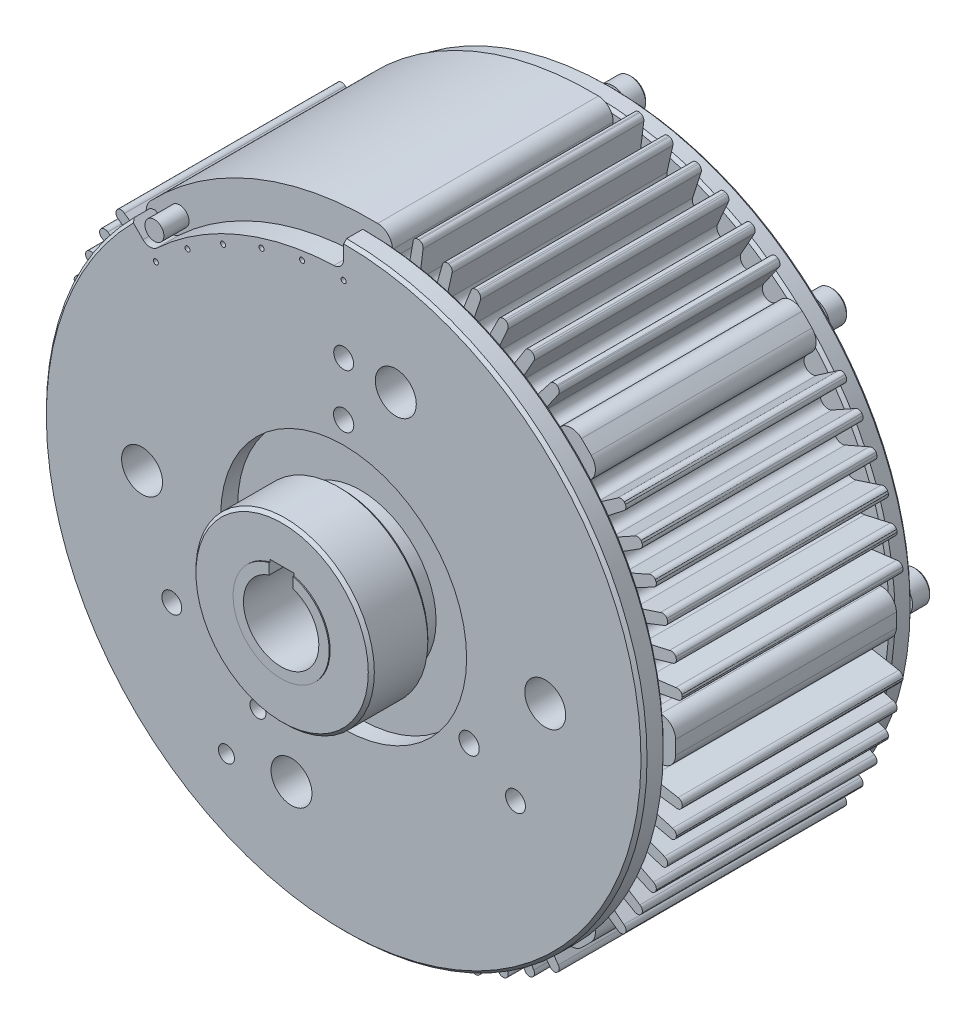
SolidWorks part; units mm, degrees
ref_plane "Front Plane" through (0, 0, 0) normal (0, 0, 1) x (1, 0, 0)
ref_plane "Top Plane" through (0, 0, 0) normal (0, 1, 0) x (1, 0, 0)
ref_plane "Right Plane" through (0, 0, 0) normal (1, 0, 0) x (0, 0, -1)
sketch "Sketch1" plane through (0, 0, 0) normal (1, 0, 0) x (0, 0, -1)
  line L0 (-15.7542, 9.5) -> (-15.7542, 12.109)
  line L1 (-15.7542, 12.109) -> (-15.506, 12.109)
  line L4 (-15.506, 12.109) -> (-15.506, 21.717)
  line L5 (-15.506, 21.717) -> (-14.744, 22.479)
  line L6 (-14.744, 22.479) -> (-1.268, 22.479)
  line L7 (-1.268, 22.479) -> (-0.506, 21.717)
  line L8 (-0.506, 21.717) -> (-0.506, 19.029)
  line L9 (-0.506, 19.029) -> (4.2672, 19.029)
  line L12 (-15.7542, 9.5) -> (88.8938, 9.5)
  line L14 (4.2672, 19.029) -> (4.2672, 30.9918)
  line L16 (4.2672, 30.9918) -> (0, 30.9918)
  line L18 (0, 30.9918) -> (0, 74.93)
  line L20 (0, 74.93) -> (0.762, 75.692)
  line L22 (0.762, 75.692) -> (4.826, 75.692)
  line L24 (4.826, 75.692) -> (5.588, 74.93)
  line L26 (5.588, 74.93) -> (5.588, 66.6115)
  line L28 (5.588, 66.6115) -> (6.848, 66.6115)
  line L30 (6.848, 66.6115) -> (6.848, 79.375)
  line L32 (6.848, 79.375) -> (62.474, 79.375)
  line L34 (62.474, 79.375) -> (62.474, 74.93)
  line L37 (62.474, 74.93) -> (63.236, 75.692)
  line L39 (63.236, 75.692) -> (67.046, 75.692)
  line L41 (67.046, 75.692) -> (67.808, 74.93)
  line L43 (67.808, 74.93) -> (67.808, 66.548)
  line L45 (67.808, 66.548) -> (71.872, 66.548)
  line L47 (71.872, 66.548) -> (72.634, 65.786)
  line L49 (72.634, 65.786) -> (72.634, 31.0007)
  line L51 (72.634, 31.0007) -> (75.652, 31.0007)
  line L53 (75.652, 31.0007) -> (76.4637, 30.1891)
  line L55 (76.4637, 30.1891) -> (76.4637, 19.3477)
  line L57 (80.895, 24.1149) -> (76.9654, 20.2995)
  line L58 (80.895, 24.1149) -> (81.8649, 23.1732)
  line L59 (81.8649, 23.1732) -> (81.6075, 22.098)
  line L61 (81.6075, 22.098) -> (86.8661, 22.098)
  line L63 (88.8938, 9.5) -> (88.8938, 13.9784)
  line L65 (88.8938, 13.9784) -> (88.3818, 14.8672)
  line L67 (88.3818, 14.8672) -> (88.3818, 20.5823)
  line L69 (-38.0952, 0) -> (104.0858, 0) construction
  arc A0 (76.9654, 20.2995) -> (76.4637, 19.3477) centre (78.178, 19.0522) ccw
  arc A1 (86.8661, 22.098) -> (88.3818, 20.5823) centre (86.8661, 20.5823) cw
  dimension "D1" = 158.75
  dimension "D2" = 62.0014
  dimension "D3" = 44.196
  dimension "D4" = 19
  dimension "D5" = 151.384
  dimension "D6" = 133.096
  dimension "D7" = 44.958
  dimension "D8" = 104.648
revolve "Revolve1" add sketch "Sketch1" angle 360 about L69
sketch "Sketch2" plane through (0, 0, -88.8938) normal (0, 0, -1) x (-1, 0, 0)
  line L0 (0, 0) -> (0, 79.375) construction
  line L1 (-3, 12.3) -> (3, 12.3)
  line L2 (-3, 12.3) -> (-3, 3.81)
  line L3 (-3, 3.81) -> (3, 3.81)
  line L4 (3, 12.3) -> (3, 3.81)
  circle A0 centre (0, 0) radius 79.375 construction
  circle A3 centre (0, 0) radius 9.5 construction
  dimension "D1" = 6
  dimension "D2" = 21.8
  dimension "D3" = 3.81
extrude "Cut-Extrude1" cut sketch "Sketch2" against normal through all
hole_wizard "1/4-20 Tapped Hole1" positions "Sketch4" profile "Sketch3" tap size "1/4-20" standard "Ansi Inch"
sketch "Sketch4" plane through (0, 0, -72.634) normal (0, 0, -1) x (-1, 0, 0)
  line L0 (0, 0) -> (0, 36.5125) construction
  line L5 (0, 0) -> (31.6208, -18.2563) construction
  line L8 (0, 0) -> (-31.6208, -18.2563) construction
  circle A1 centre (0, 0) radius 36.5125
  point P0 (31.6208, -18.2563)
  point P33 (-31.6208, -18.2563)
  point P35 (0, 36.5125)
  dimension "D1" = 73.025
  dimension "D2" = 120
  dimension "D3" = 120
sketch "Sketch3" plane through (-31.6208, -18.2563, -72.634) normal (1, 0, 0) x (0, 1, 0)
  line L0 (0, 0) -> (0, 12.7098)
  line L1 (0, 12.7098) -> (2.5527, 11.176)
  line L2 (2.5527, 11.176) -> (2.5527, 0)
  line L5 (2.5527, 0) -> (0, 0)
  line L10 (0, 12.7098) -> (-2.5527, 11.176) construction
  line L11 (0, -6.35) -> (0, 107.95) construction
  dimension "Tap Drill Dia." = 5.1054
  dimension "Tap Drill Depth" = 11.176
  dimension "Drill Angle" = 118
hole_wizard "M6x1.0 Tapped Hole1" positions "Sketch6" profile "Sketch5" tap size "M6x1.0" standard "Ansi Metric"
sketch "Sketch6" plane through (0, 0, -72.634) normal (0, 0, -1) x (-1, 0, 0)
  line L0 (0, 0) -> (0, 49.9999) construction
  line L3 (0, 0) -> (43.3012, -25) construction
  line L6 (0, 0) -> (-43.3012, -25) construction
  circle A0 centre (0, 0) radius 49.9999
  point P0 (0, 49.9999)
  point P26 (-43.3012, -25)
  point P28 (43.3012, -25)
  dimension "D1" = 99.9998
  dimension "D2" = 120
  dimension "D3" = 120
sketch "Sketch5" plane through (0, 49.9999, -72.634) normal (1, 0, 0) x (0, 1, 0)
  line L0 (0, 0) -> (0, 16.4882)
  line L1 (0, 16.4882) -> (2.5, 14.986)
  line L2 (2.5, 14.986) -> (2.5, 0)
  line L5 (2.5, 0) -> (0, 0)
  line L10 (0, 16.4882) -> (-2.5, 14.986) construction
  line L11 (0, -6.35) -> (0, 107.95) construction
  dimension "Tap Drill Dia." = 5
  dimension "Tap Drill Depth" = 14.986
  dimension "Drill Angle" = 118
hole_wizard "13/32 (0.40625) Diameter Hole1" positions "Sketch8" profile "Sketch7" hole size "13/32" standard "Ansi Inch"
sketch "Sketch8" plane through (0, 0, -72.634) normal (0, 0, -1) x (-1, 0, 0)
  line L1 (-50.8, 0) -> (50.8, 0) construction
  circle A0 centre (0, 0) radius 50.8
  point P0 (50.8, 0)
  point P15 (-50.8, 0)
  dimension "D1" = 101.6
sketch "Sketch7" plane through (-50.8, 0, -72.634) normal (1, 0, 0) x (0, 1, 0)
  line L0 (0, 0) -> (0, 12.7521)
  line L1 (0, 12.7521) -> (5.1594, 9.652)
  line L2 (5.1594, 9.652) -> (5.1594, 0)
  line L5 (5.1594, 0) -> (0, 0)
  line L10 (0, 12.7521) -> (-5.1594, 9.652) construction
  line L11 (0, -6.35) -> (0, 107.95) construction
  dimension "Hole Dia." = 10.3187
  dimension "Hole Depth" = 9.652
  dimension "Drill Angle" = 118
sketch "Sketch9" plane through (0, 0, 0) normal (1, 0, 0) x (0, 0, -1)
  line L0 (41.0601, 71.5899) -> (104.2946, 71.5899) construction
  line L1 (0, 0) -> (133.1346, 0) construction
  line L2 (67.808, -74.93) -> (67.808, 74.93) construction
  line L3 (67.808, 75.5586) -> (72.126, 75.5587)
  line L4 (67.808, 75.5586) -> (67.808, 71.5899)
  line L5 (67.808, 71.5899) -> (72.634, 71.5899)
  line L6 (72.634, 75.0507) -> (72.634, 71.5899)
  line L7 (72.126, 75.5587) -> (72.634, 75.0507)
  point P8 (72.634, 75.5587)
  dimension "D1" = 71.5899
  dimension "D2" = 7.9375
  dimension "D3" = 4.826
revolve "Revolve2" add sketch "Sketch9" angle 360 about L0
pattern_circular "CirPattern1" count 8 over 360 about axis through (0, 0, 0) along (0, 0, 1) of "Revolve2"
ref_plane "Plane1" through (0, 0, -36.317) normal (0, 0, -1) x (-1, 0, 0)
mirror "Mirror1" about plane through (0, 0, -36.317) normal (0, 0, -1) of "1/4-20 Tapped Hole1", "M6x1.0 Tapped Hole1"
hole_wizard "13/32 (0.40625) Diameter Hole2" positions "Sketch11" profile "Sketch10" hole size "13/32" standard "Ansi Inch"
sketch "Sketch11" plane through (0, 0, 0) normal (0, 0, 1) x (1, 0, 0)
  line L0 (0, 0) -> (13.148, 49.069) construction
  line L2 (0, 0) -> (0, 50.8) construction
  circle A0 centre (0, 0) radius 50.8
  point P0 (-50.8, 0)
  point P1 (13.148, 49.069)
  dimension "D1" = 101.6
  dimension "D2" = 15
sketch "Sketch10" plane through (-50.8, 0, 0) normal (1, 0, 0) x (0, -1, 0)
  line L0 (0, 0) -> (0, 12.7521)
  line L1 (0, 12.7521) -> (5.1594, 9.652)
  line L2 (5.1594, 9.652) -> (5.1594, 0)
  line L5 (5.1594, 0) -> (0, 0)
  line L10 (0, 12.7521) -> (-5.1594, 9.652) construction
  line L11 (0, -6.35) -> (0, 107.95) construction
  dimension "Hole Dia." = 10.3187
  dimension "Hole Depth" = 9.652
  dimension "Drill Angle" = 118
pattern_circular "CirPattern2" count 2 over 360 about axis through (0, 0, 0) along (0, 0, 1) of "13/32 (0.40625) Diameter Hole2"
hole_wizard "#10-32 Tapped Hole1" positions "Sketch13" profile "Sketch12" tap size "#10-32" standard "Ansi Inch"
sketch "Sketch13" plane through (0, 0, 0) normal (0, 0, 1) x (1, 0, 0)
  line L0 (0, 0) -> (-79.375, 0) construction
  line L3 (0, 0) -> (0, -79.375) construction
  circle A0 centre (0, 0) radius 79.375 construction
  point P0 (-21.59, -37.3888)
  point P1 (-29.5402, -51.1556)
  dimension "D1" = 37.3888
  dimension "D2" = 51.1556
  dimension "D3" = 21.59
  dimension "D4" = 29.5402
sketch "Sketch12" plane through (-21.59, -37.3888, 0) normal (1, 0, 0) x (0, -1, 0)
  line L0 (0, 0) -> (0, 13.1513)
  line L1 (0, 13.1513) -> (2.0193, 11.938)
  line L2 (2.0193, 11.938) -> (2.0193, 0)
  line L5 (2.0193, 0) -> (0, 0)
  line L10 (0, 13.1513) -> (-2.0193, 11.938) construction
  line L11 (0, -6.35) -> (0, 107.95) construction
  dimension "Tap Drill Dia." = 4.0386
  dimension "Tap Drill Depth" = 11.938
  dimension "Drill Angle" = 118
sketch "Sketch14" plane through (0, 0, -6.848) normal (0, 0, 1) x (1, 0, 0)
  line L0 (10.6424, 77.1963) -> (9.4533, 70.7158)
  line L1 (13.1677, 77.0031) -> (12.2964, 70.0161)
  line L2 (17.9925, 75.8239) -> (16.1837, 69.4733)
  line L3 (20.4876, 75.3895) -> (18.9902, 68.7651)
  line L4 (25.1772, 73.7532) -> (22.8077, 67.8522)
  line L5 (27.6191, 73.0818) -> (25.4307, 66.3893)
  line L6 (32.1303, 71.0035) -> (29.143, 65.1148)
  line L7 (34.4966, 70.1011) -> (31.6768, 63.6492)
  line L8 (38.7879, 67.6) -> (35.2499, 62.0247)
  line L9 (41.0568, 66.475) -> (37.6316, 60.3231)
  line L10 (45.0897, 63.557) -> (41.0325, 58.3636)
  line L11 (47.2404, 62.2196) -> (43.3761, 56.6542)
  line L12 (47.785, 55.4962) -> (46.4179, 54.129)
  line L13 (55.4788, 47.7677) -> (54.0982, 46.3871)
  line L14 (62.1202, 47.0826) -> (56.7408, 43.3669)
  line L15 (63.7692, 45.1604) -> (58.2125, 40.8359)
  line L16 (66.347, 40.9149) -> (60.5774, 37.7033)
  line L17 (67.8041, 38.8435) -> (61.8585, 35.0715)
  line L18 (69.9631, 34.3704) -> (63.9124, 31.7266)
  line L19 (71.215, 32.1688) -> (64.9353, 28.9841)
  line L20 (72.9354, 27.5094) -> (66.6591, 25.4578)
  line L21 (73.9705, 25.198) -> (67.4145, 22.6298)
  line L23 (75.2364, 20.3952) -> (68.7923, 18.9546)
  line L24 (76.0452, 17.9952) -> (69.2732, 16.0672)
  line L25 (77.42, 10.6267) -> (70.7155, 9.4172)
  line L26 (76.8449, 13.0932) -> (70.2924, 12.2768)
  line L27 (73.0099, 5.4579) -> (71.0698, 5.4579)
  line L28 (73.0099, -5.4611) -> (71.0698, -5.4611)
  line L29 (77.42, -10.626) -> (70.7155, -9.4231)
  line L30 (76.8449, -13.0925) -> (70.2924, -12.2761)
  line L31 (69.2732, -16.0665) -> (76.0452, -17.9945)
  line L32 (75.2364, -20.3945) -> (68.7923, -18.9538)
  line L33 (67.4145, -22.6291) -> (73.9705, -25.1973)
  line L34 (72.9354, -27.5087) -> (66.6591, -25.4571)
  line L35 (64.9353, -28.9834) -> (71.215, -32.1681)
  line L36 (69.9631, -34.3697) -> (63.9124, -31.7259)
  line L37 (61.8585, -35.0707) -> (67.8041, -38.8427)
  line L38 (66.347, -40.9142) -> (60.5774, -37.7026)
  line L39 (58.2125, -40.8352) -> (63.7692, -45.1597)
  line L40 (62.1202, -47.0819) -> (56.7408, -43.3311)
  line L41 (55.4788, -47.7677) -> (54.0982, -46.3871)
  line L42 (47.785, -55.4962) -> (46.4179, -54.129)
  line L43 (43.3761, -56.6956) -> (47.2404, -62.2532)
  line L44 (45.0897, -63.5905) -> (41.0325, -58.3629)
  line L45 (37.6316, -60.3224) -> (41.0568, -66.4742)
  line L46 (38.7879, -67.5993) -> (35.2499, -62.024)
  line L47 (31.6768, -63.6485) -> (34.4966, -70.1004)
  line L48 (32.1303, -71.0028) -> (29.143, -65.1141)
  line L49 (25.4307, -66.3886) -> (27.6191, -73.081)
  line L50 (25.1772, -73.7525) -> (22.8077, -67.3576)
  line L51 (18.9902, -68.2705) -> (20.4876, -75.3888)
  line L52 (17.9925, -75.8231) -> (16.1837, -69.4726)
  line L53 (12.2964, -70.0154) -> (13.1677, -77.0024)
  line L54 (10.6424, -77.1956) -> (9.4533, -70.7151)
  line L55 (5.4611, -71.0794) -> (5.4611, -73.0028)
  line L56 (-5.4609, -73.0099) -> (-5.4609, -71.0794)
  line L57 (-9.3916, -70.7151) -> (-10.5808, -77.1956)
  line L58 (-13.106, -77.0024) -> (-12.2347, -70.0154)
  line L59 (-16.122, -69.4726) -> (-17.9308, -75.8231)
  line L60 (-20.4259, -75.3888) -> (-18.8493, -68.2705)
  line L61 (-22.6667, -67.3576) -> (-25.1726, -73.7525)
  line L62 (-27.4977, -73.081) -> (-25.3092, -66.3886)
  line L63 (-29.1468, -65.1141) -> (-32.1341, -71.0028)
  line L64 (-34.3653, -70.1004) -> (-31.5454, -63.6485)
  line L65 (-35.267, -62.024) -> (-38.8049, -67.5993)
  line L66 (-40.9097, -66.4742) -> (-37.5699, -60.3224)
  line L67 (-40.9709, -58.3629) -> (-45.0258, -63.5905)
  line L68 (-47.1765, -62.2532) -> (-43.2968, -56.6956)
  line L69 (-54.0982, -46.3871) -> (-55.4788, -47.7677)
  line L70 (-47.785, -55.4962) -> (-46.4179, -54.129)
  line L71 (-56.6445, -43.3311) -> (-62.0585, -47.0819)
  line L72 (-63.7075, -45.1597) -> (-58.1508, -40.8352)
  line L73 (-60.5158, -37.7026) -> (-66.2853, -40.9142)
  line L74 (-67.7424, -38.8427) -> (-61.7969, -35.0707)
  line L75 (-63.8507, -31.7259) -> (-69.9015, -34.3697)
  line L76 (-71.1534, -32.1681) -> (-64.8736, -28.9834)
  line L77 (-66.5974, -25.4571) -> (-72.8737, -27.5087)
  line L78 (-73.9089, -25.1973) -> (-67.3528, -22.6291)
  line L79 (-68.7307, -18.9538) -> (-75.1747, -20.3945)
  line L80 (-75.9836, -17.9945) -> (-69.2115, -16.0665)
  line L81 (-70.2308, -12.2761) -> (-76.7832, -13.0925)
  line L82 (-77.3583, -10.626) -> (-70.6905, -9.4231)
  line L83 (-56.6445, 43.3669) -> (-62.0585, 47.0826)
  line L84 (-63.7075, 45.1604) -> (-58.1508, 40.8359)
  line L85 (-60.5158, 37.7033) -> (-66.2853, 40.9149)
  line L86 (-67.7424, 38.8435) -> (-61.7969, 35.0715)
  line L87 (-63.8507, 31.7266) -> (-69.9015, 34.3704)
  line L88 (-71.1534, 32.1689) -> (-64.8736, 28.9841)
  line L89 (-67.3528, 22.6298) -> (-73.9089, 25.1981)
  line L90 (-72.8737, 27.5094) -> (-66.5974, 25.4578)
  line L91 (-68.7307, 18.9546) -> (-75.1747, 20.3952)
  line L92 (-75.9836, 17.9952) -> (-69.2115, 16.0672)
  line L93 (-70.2308, 12.2768) -> (-76.7832, 13.0932)
  line L94 (-70.6905, 9.4172) -> (-77.3583, 10.6267)
  line L95 (-71.0621, 5.4579) -> (-73.0131, 5.4579)
  line L96 (-71.0621, -5.4579) -> (-73.0131, -5.4579)
  line L97 (5.4611, 73.0099) -> (5.4611, 71.0794)
  line L98 (-53.9246, 46.1857) -> (-55.4788, 47.7677)
  arc A1 (1.7372, 76.8189) -> (0, 76.8385) centre (0, 0) ccw
  arc A2 (5.4611, 73.0099) -> (1.7372, 76.8189) centre (1.6511, 73.0099) ccw
  arc A3 (13.1677, 77.0031) -> (10.6424, 77.1963) centre (11.9124, 77.1963) ccw
  arc A4 (5.4611, 71.0794) -> (9.4533, 70.7158) centre (7.4572, 70.8976) ccw
  arc A5 (20.4876, 75.3895) -> (17.9925, 75.8239) centre (19.2566, 75.7021) ccw
  arc A6 (12.2964, 70.0161) -> (16.1837, 69.4733) centre (14.2779, 70.0161) ccw
  arc A7 (27.6191, 73.0818) -> (25.1772, 73.7532) centre (26.4238, 73.5109) ccw
  arc A8 (18.9902, 68.7651) -> (22.8077, 67.8522) centre (20.9627, 68.5752) ccw
  arc A9 (34.4966, 70.1011) -> (32.1303, 71.0035) centre (33.348, 70.6428) ccw
  arc A10 (25.4307, 66.3893) -> (29.143, 65.1148) centre (27.3758, 66.0112) ccw
  arc A11 (-1.7372, -76.8189) -> (0, -76.8385) centre (0, 0) ccw
  arc A12 (62.1202, -47.0819) -> (63.7692, -45.1597) centre (63.0182, -46.1839) ccw
  arc A13 (60.5774, -37.7026) -> (58.2125, -40.8352) centre (59.6137, -39.434) ccw
  arc A14 (66.347, -40.9142) -> (67.8041, -38.8427) centre (67.1548, -39.9342) ccw
  arc A15 (63.9124, -31.7259) -> (61.8585, -35.0707) centre (63.119, -33.5417) ccw
  arc A16 (69.9631, -34.3697) -> (71.215, -32.1681) centre (70.6733, -33.3168) ccw
  arc A17 (66.6591, -25.4571) -> (64.9353, -28.9834) centre (66.0434, -27.3406) ccw
  arc A18 (72.9354, -27.5087) -> (73.9705, -25.1973) centre (73.5414, -26.3926) ccw
  arc A19 (68.7923, -18.9538) -> (67.4145, -22.6291) centre (68.36, -20.8877) ccw
  arc A20 (75.2364, -20.3945) -> (76.0452, -17.9945) centre (75.7326, -19.2254) ccw
  arc A21 (70.2924, -12.2761) -> (69.2732, -16.0665) centre (70.0475, -14.2424) ccw
  arc A22 (76.8449, -13.0925) -> (77.42, -10.626) centre (77.2268, -11.8812) ccw
  arc A23 (41.0325, -58.3629) -> (37.6316, -60.3224) centre (39.4689, -59.5801) ccw
  arc A24 (45.0897, -63.5905) -> (47.2404, -62.2532) centre (46.2162, -63.0041) ccw
  arc A25 (71.0698, -5.4611) -> (70.7155, -9.4231) centre (71.0724, -7.4582) ccw
  arc A26 (73.0099, -5.4611) -> (76.8189, -1.7372) centre (73.0099, -1.6511) ccw
  arc A27 (76.8189, -1.7372) -> (76.8385, 0) centre (0, 0) ccw
  arc A28 (46.4179, -54.129) -> (43.3761, -56.6956) centre (45.0057, -55.5412) ccw
  arc A29 (54.0982, 46.3871) -> (56.7408, 43.3669) centre (55.5535, 44.9942) ccw
  arc A30 (55.4788, 47.7677) -> (55.5437, 53.0948) centre (52.792, 50.4644) ccw
  arc A31 (41.0568, 66.475) -> (38.7879, 67.6) centre (39.9654, 67.1243) ccw
  arc A32 (31.6768, 63.6492) -> (35.2499, 62.0247) centre (33.5768, 63.0864) ccw
  arc A33 (53.0962, 55.5424) -> (47.785, 55.4962) centre (50.4644, 52.7893) ccw
  arc A34 (55.5437, 53.0948) -> (53.0962, 55.5424) centre (0, 0) ccw
  arc A35 (43.3761, 56.6542) -> (46.4179, 54.129) centre (45.0057, 55.5226) ccw
  arc A36 (76.8385, 0) -> (76.8189, 1.7372) centre (0, 0) ccw
  arc A37 (76.8189, 1.7372) -> (73.0099, 5.4579) centre (73.0099, 1.6478) ccw
  arc A38 (70.7155, 9.4172) -> (71.0698, 5.4579) centre (71.0698, 7.4534) ccw
  arc A39 (47.2404, 62.2196) -> (45.0897, 63.557) centre (46.2162, 62.9706) ccw
  arc A40 (37.6316, 60.3231) -> (41.0325, 58.3636) centre (39.4689, 59.5808) ccw
  arc A41 (77.42, 10.6267) -> (76.8449, 13.0932) centre (77.2268, 11.882) ccw
  arc A42 (69.2732, 16.0672) -> (70.2924, 12.2768) centre (70.0475, 14.2432) ccw
  arc A43 (76.0452, 17.9952) -> (75.2364, 20.3952) centre (75.7326, 19.2262) ccw
  arc A44 (67.4145, 22.6298) -> (68.7923, 18.9546) centre (68.36, 20.8884) ccw
  arc A45 (73.9705, 25.198) -> (72.9354, 27.5094) centre (73.5414, 26.3933) ccw
  arc A46 (64.9353, 28.9841) -> (66.6591, 25.4578) centre (66.0434, 27.3413) ccw
  arc A47 (71.215, 32.1688) -> (69.9631, 34.3704) centre (70.6733, 33.3175) ccw
  arc A48 (61.8585, 35.0715) -> (63.9124, 31.7266) centre (63.119, 33.5424) ccw
  arc A49 (67.8041, 38.8435) -> (66.347, 40.9149) centre (67.1548, 39.9349) ccw
  arc A50 (58.2125, 40.8359) -> (60.5774, 37.7033) centre (59.6137, 39.4347) ccw
  arc A51 (63.7692, 45.1604) -> (62.1202, 47.0826) centre (63.0182, 46.1846) ccw
  arc A52 (0, 76.8385) -> (-55.5437, 53.0948) centre (0, 0) ccw
  arc A53 (-56.6445, 43.3669) -> (-53.9246, 46.1857) centre (-55.5104, 44.9942) ccw
  arc A54 (-55.5437, 53.0948) -> (-55.4788, 47.7677) centre (-52.792, 50.4644) ccw
  arc A55 (-76.8189, 1.7372) -> (-76.8385, 0) centre (0, 0) ccw
  arc A56 (-73.0131, 5.4579) -> (-76.8189, 1.7372) centre (-73.0131, 1.6511) ccw
  arc A57 (-71.0621, 5.4579) -> (-70.6905, 9.4172) centre (-71.0621, 7.455) ccw
  arc A58 (-76.7832, 13.0932) -> (-77.3583, 10.6267) centre (-77.1651, 11.882) ccw
  arc A59 (-70.2308, 12.2768) -> (-69.2115, 16.0672) centre (-69.9858, 14.2432) ccw
  arc A60 (-75.1747, 20.3952) -> (-75.9836, 17.9952) centre (-75.6709, 19.2262) ccw
  arc A61 (-76.8385, 0) -> (-76.8189, -1.7372) centre (0, 0) ccw
  arc A62 (-76.8189, -1.7372) -> (-73.0131, -5.4579) centre (-73.0131, -1.6511) ccw
  arc A63 (-70.6905, -9.4231) -> (-71.0621, -5.4579) centre (-71.0277, -7.4547) ccw
  arc A64 (-47.1765, -62.2532) -> (-45.0258, -63.5905) centre (-46.1523, -63.0041) ccw
  arc A65 (-37.5699, -60.3224) -> (-40.9709, -58.3629) centre (-39.4072, -59.5801) ccw
  arc A66 (-77.3583, -10.626) -> (-76.7832, -13.0925) centre (-77.1651, -11.8812) ccw
  arc A67 (-69.2115, -16.0665) -> (-70.2308, -12.2761) centre (-69.9858, -14.2424) ccw
  arc A68 (-75.9836, -17.9945) -> (-75.1747, -20.3945) centre (-75.6709, -19.2254) ccw
  arc A69 (-67.3528, -22.6291) -> (-68.7307, -18.9538) centre (-68.2983, -20.8877) ccw
  arc A70 (-73.9089, -25.1973) -> (-72.8737, -27.5087) centre (-73.4797, -26.3926) ccw
  arc A71 (-64.8736, -28.9834) -> (-66.5974, -25.4571) centre (-65.9817, -27.3406) ccw
  arc A72 (-71.1534, -32.1681) -> (-69.9015, -34.3697) centre (-70.6116, -33.3168) ccw
  arc A73 (-61.7969, -35.0707) -> (-63.8507, -31.7259) centre (-63.0573, -33.5417) ccw
  arc A74 (-67.7424, -38.8427) -> (-66.2853, -40.9142) centre (-67.0931, -39.9342) ccw
  arc A75 (-58.1508, -40.8352) -> (-60.5158, -37.7026) centre (-59.552, -39.434) ccw
  arc A76 (-63.7075, -45.1597) -> (-62.0585, -47.0819) centre (-62.9565, -46.1839) ccw
  arc A77 (-5.4609, -73.0099) -> (-1.7372, -76.8189) centre (-1.6509, -73.0099) ccw
  arc A78 (-13.106, -77.0024) -> (-10.5808, -77.1956) centre (-11.8508, -77.1956) ccw
  arc A79 (-5.4609, -71.0794) -> (-9.3916, -70.7151) centre (-7.4544, -71.2005) ccw
  arc A80 (-20.4259, -75.3888) -> (-17.9308, -75.8231) centre (-19.195, -75.7014) ccw
  arc A81 (-12.2347, -70.0154) -> (-16.122, -69.4726) centre (-14.2163, -70.0154) ccw
  arc A82 (-27.4977, -73.081) -> (-25.1726, -73.7525) centre (-26.3621, -73.5102) ccw
  arc A83 (-18.8493, -68.2705) -> (-22.6667, -67.3576) centre (-20.8217, -68.0806) ccw
  arc A84 (-34.3653, -70.1004) -> (-32.1341, -71.0028) centre (-33.2863, -70.6421) ccw
  arc A85 (-25.3092, -66.3886) -> (-29.1468, -65.1141) centre (-27.3141, -66.0105) ccw
  arc A86 (-40.9097, -66.4742) -> (-38.8049, -67.5993) centre (-39.9037, -67.1236) ccw
  arc A87 (-31.5454, -63.6485) -> (-35.267, -62.024) centre (-33.5151, -63.0857) ccw
  arc A88 (-54.0982, -46.3871) -> (-56.6445, -43.3311) centre (-55.5104, -44.9749) ccw
  arc A89 (-55.4788, -47.7677) -> (-55.5437, -53.0948) centre (-52.792, -50.4644) ccw
  arc A90 (-55.5437, -53.0948) -> (-53.0962, -55.5424) centre (0, 0) ccw
  arc A91 (-53.0962, -55.5424) -> (-47.785, -55.4962) centre (-50.4644, -52.7893) ccw
  arc A92 (-43.2968, -56.6956) -> (-46.4179, -54.129) centre (-44.9634, -55.5412) ccw
  arc A93 (47.785, -55.4962) -> (53.0962, -55.5424) centre (50.4644, -52.7893) ccw
  arc A94 (53.0962, -55.5424) -> (55.5437, -53.0948) centre (0, 0) ccw
  arc A95 (55.5437, -53.0948) -> (55.4788, -47.7677) centre (52.792, -50.4644) ccw
  arc A96 (56.7408, -43.3311) -> (54.0982, -46.3871) centre (55.5535, -44.9749) ccw
  arc A97 (35.2499, -62.024) -> (31.6768, -63.6485) centre (33.5768, -63.0857) ccw
  arc A98 (38.7879, -67.5993) -> (41.0568, -66.4742) centre (39.9654, -67.1236) ccw
  arc A99 (29.143, -65.1141) -> (25.4307, -66.3886) centre (27.3758, -66.0105) ccw
  arc A100 (32.1303, -71.0028) -> (34.4966, -70.1004) centre (33.348, -70.6421) ccw
  arc A101 (22.8077, -67.3576) -> (18.9902, -68.2705) centre (20.9627, -68.0806) ccw
  arc A102 (25.1772, -73.7525) -> (27.6191, -73.081) centre (26.4238, -73.5102) ccw
  arc A103 (16.1837, -69.4726) -> (12.2964, -70.0154) centre (14.2779, -70.0154) ccw
  arc A104 (17.9925, -75.8231) -> (20.4876, -75.3888) centre (19.2566, -75.7014) ccw
  arc A105 (9.4533, -70.7151) -> (5.4611, -71.0794) centre (7.4572, -70.8973) ccw
  arc A106 (10.6424, -77.1956) -> (13.1677, -77.0024) centre (11.9124, -77.1956) ccw
  arc A107 (1.7372, -76.8189) -> (5.4611, -73.0028) centre (1.6511, -73.0099) ccw
  arc A108 (0, -76.8385) -> (1.7372, -76.8189) centre (0, 0) ccw
  arc A109 (-62.0585, 47.0826) -> (-63.7075, 45.1604) centre (-62.9565, 46.1846) ccw
  arc A110 (-60.5158, 37.7033) -> (-58.1508, 40.8359) centre (-59.552, 39.4347) ccw
  arc A111 (-66.2853, 40.9149) -> (-67.7424, 38.8435) centre (-67.0931, 39.9349) ccw
  arc A112 (-63.8507, 31.7266) -> (-61.7969, 35.0715) centre (-63.0573, 33.5424) ccw
  arc A113 (-69.9015, 34.3704) -> (-71.1534, 32.1689) centre (-70.6116, 33.3175) ccw
  arc A114 (-66.5974, 25.4578) -> (-64.8736, 28.9841) centre (-65.9817, 27.3413) ccw
  arc A115 (-72.8737, 27.5094) -> (-73.9089, 25.1981) centre (-73.4797, 26.3934) ccw
  arc A116 (-68.7307, 18.9546) -> (-67.3528, 22.6298) centre (-68.2983, 20.8884) ccw
extrude "Cut-Extrude2" cut sketch "Sketch14" against normal up to surface (55.626 mm away) flip side to cut
sketch "Sketch17" plane through (0, 0, 0) normal (0, 0, 1) x (1, 0, 0)
  line L0 (0, 71.5067) -> (0, 82.1635)
  line L1 (-50.5629, 50.5629) -> (-65.2914, 65.2914)
  line L2 (-65.2914, 65.2914) -> (0, 82.1635)
  line L3 (0, 0) -> (-71.8719, 71.8719) construction
  line L4 (0, 0) -> (0, 91.2446) construction
  line L5 (0, 0) -> (-39.3399, 54.1467) construction
  line L6 (0, 0) -> (-30.3851, 59.6342) construction
  line L7 (0, 0) -> (-20.6822, 63.6533) construction
  line L8 (0, 0) -> (-10.47, 66.105) construction
  circle A0 centre (0, 0) radius 66.929 construction
  arc A1 (-2.4498, 68.9683) -> (-47.0357, 50.5002) centre (0, 0) ccw
  arc A2 (-2.4498, 68.9683) -> (0, 71.5067) centre (-2.54, 71.5067) ccw
  arc A3 (-47.0357, 50.5002) -> (-50.5629, 50.5629) centre (-48.7668, 52.3589) cw
  circle A4 centre (-47.3259, 47.3259) radius 0.635
  circle A5 centre (-39.3399, 54.1467) radius 0.635
  circle A6 centre (-30.3851, 59.6342) radius 0.635
  circle A7 centre (-20.6822, 63.6533) radius 0.635
  circle A8 centre (-10.47, 66.105) radius 0.635
  circle A9 centre (0, 66.929) radius 0.635
  dimension "D2" = 133.858
  dimension "D3" = 138.0236
  dimension "D4" = 2.54
  dimension "D1" = 1.27
  dimension "D5" = 45
  dimension "D6" = 9
  dimension "D7" = 18
  dimension "D8" = 27
  dimension "D9" = 9
extrude "Cut-Extrude6" cut sketch "Sketch17" against normal up to surface (5.588 mm away)
sketch "Sketch18" plane through (0, 0, -6.848) normal (0, 0, 1) x (1, 0, 0)
  line L0 (0, 0) -> (0, 76.8385) construction
  line L1 (0, 0) -> (-51.415, 57.1022) construction
  circle A0 centre (-48.1834, 53.5131) radius 2.3876
  arc A1 (1.7372, 76.8189) -> (-55.5437, 53.0948) centre (0, 0) ccw construction
  circle A2 centre (0, 0) radius 72.009 construction
  dimension "D1" = 4.7752
  dimension "D2" = 144.018
  dimension "D3" = 42
extrude "Boss-Extrude1" add sketch "Sketch18" along normal blind 6.35
